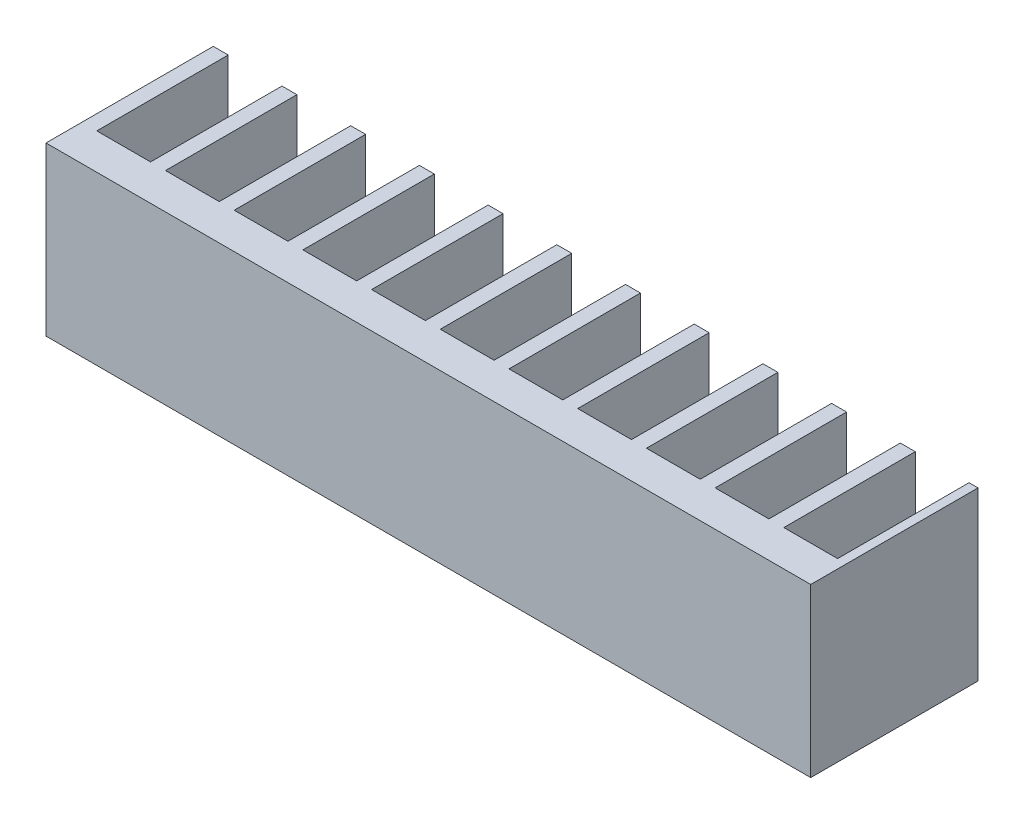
SolidWorks part; units mm, degrees
ref_plane "Front Plane" through (0, 0, 0) normal (0, 0, 1) x (1, 0, 0)
ref_plane "Top Plane" through (0, 0, 0) normal (0, 1, 0) x (1, 0, 0)
ref_plane "Right Plane" through (0, 0, 0) normal (1, 0, 0) x (0, 0, -1)
sketch "Sketch1" plane through (0, 0, 0) normal (0, 1, 0) x (1, 0, 0)
  line L0 (-30.75, 7) -> (-30.75, -4)
  line L1 (-32, 7) -> (-30.75, 7)
  line L2 (-32, 7) -> (-32, -7)
  line L3 (-32, -7) -> (32, -7)
  line L4 (32, 7) -> (32, -7)
  line L5 (-32, 7) -> (-30.75, 6.7266) construction
  line L6 (-32, -7) -> (26.75, 5.8516) construction
  line L7 (-30.75, -4) -> (-26.25, -4)
  line L8 (-26.25, -4) -> (-26.25, 7)
  line L9 (-20.5, -4) -> (-20.5, 7)
  line L10 (-25, 7) -> (-25, -4)
  line L11 (-25, -4) -> (-20.5, -4)
  line L12 (-14.75, -4) -> (-14.75, 7)
  line L13 (-19.25, 7) -> (-19.25, -4)
  line L14 (-19.25, -4) -> (-14.75, -4)
  line L15 (-9, -4) -> (-9, 7)
  line L16 (-13.5, 7) -> (-13.5, -4)
  line L17 (-13.5, -4) -> (-9, -4)
  line L18 (-3.25, -4) -> (-3.25, 7)
  line L19 (-7.75, 7) -> (-7.75, -4)
  line L20 (-7.75, -4) -> (-3.25, -4)
  line L21 (2.5, -4) -> (2.5, 7)
  line L22 (-2, 7) -> (-2, -4)
  line L23 (-2, -4) -> (2.5, -4)
  line L24 (8.25, -4) -> (8.25, 7)
  line L25 (3.75, 7) -> (3.75, -4)
  line L26 (3.75, -4) -> (8.25, -4)
  line L27 (14, -4) -> (14, 7)
  line L28 (9.5, 7) -> (9.5, -4)
  line L29 (9.5, -4) -> (14, -4)
  line L30 (19.75, -4) -> (19.75, 7)
  line L31 (15.25, 7) -> (15.25, -4)
  line L32 (15.25, -4) -> (19.75, -4)
  line L33 (25.5, -4) -> (25.5, 7)
  line L34 (21, 7) -> (21, -4)
  line L35 (21, -4) -> (25.5, -4)
  line L36 (31.25, -4) -> (31.25, 7)
  line L37 (26.75, 7) -> (26.75, -4)
  line L38 (26.75, -4) -> (31.25, -4)
  line L39 (31.25, 7) -> (32, 7)
  line L40 (31.25, 6.8359) -> (32, 7) construction
  line L41 (25.5, 7) -> (26.75, 7)
  line L42 (19.75, 7) -> (21, 7)
  line L43 (14, 7) -> (15.25, 7)
  line L44 (8.25, 7) -> (9.5, 7)
  line L45 (2.5, 7) -> (3.75, 7)
  line L46 (-3.25, 7) -> (-2, 7)
  line L47 (-9, 7) -> (-7.75, 7)
  line L48 (-14.75, 7) -> (-13.5, 7)
  line L49 (-20.5, 7) -> (-19.25, 7)
  line L50 (-20.5, 4.4844) -> (32, -7) construction
  line L51 (-26.25, 7) -> (-25, 7)
  line L52 (-26.25, 5.7422) -> (-25, 5.4688) construction
  point P0 (0, 0)
  dimension "D1" = 64
  dimension "D2" = 14
  dimension "D3" = 1.25
  dimension "D4" = 11
  dimension "D5" = 4.5
  dimension "D6" = 11
extrude "Boss-Extrude1" add sketch "Sketch1" along normal blind 14
